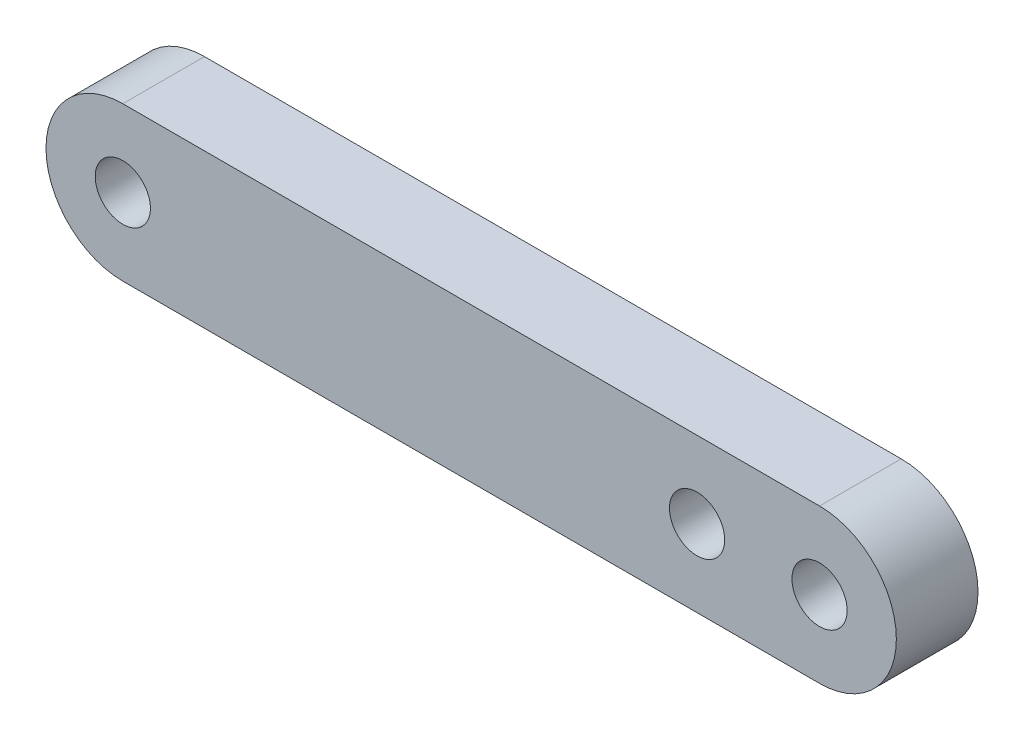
SolidWorks part; units mm, degrees
ref_plane "Front Plane" through (0, 0, 0) normal (0, 0, 1) x (1, 0, 0)
ref_plane "Top Plane" through (0, 0, 0) normal (0, 1, 0) x (1, 0, 0)
ref_plane "Right Plane" through (0, 0, 0) normal (1, 0, 0) x (0, 0, -1)
sketch "Sketch1" plane through (0, 0, 0) normal (0, 0, 1) x (1, 0, 0)
  line L0 (0, 0) -> (1734, 0) construction
  line L1 (0, 191.2197) -> (1734, 191.2197)
  line L2 (0, -191.2197) -> (1734, -191.2197)
  arc A0 (0, 191.2197) -> (0, -191.2197) centre (0, 0) ccw
  arc A1 (1734, -191.2197) -> (1734, 191.2197) centre (1734, 0) ccw
  circle A2 centre (0, 0) radius 68.6903
  circle A3 centre (1734, 0) radius 68.6903
  circle A4 centre (1429.2, 0) radius 68.6903
  point P3 (867, 0)
  dimension "D1" = 1734
  dimension "D2" = 304.8
extrude "Boss-Extrude1" add sketch "Sketch1" along normal blind 203.2
